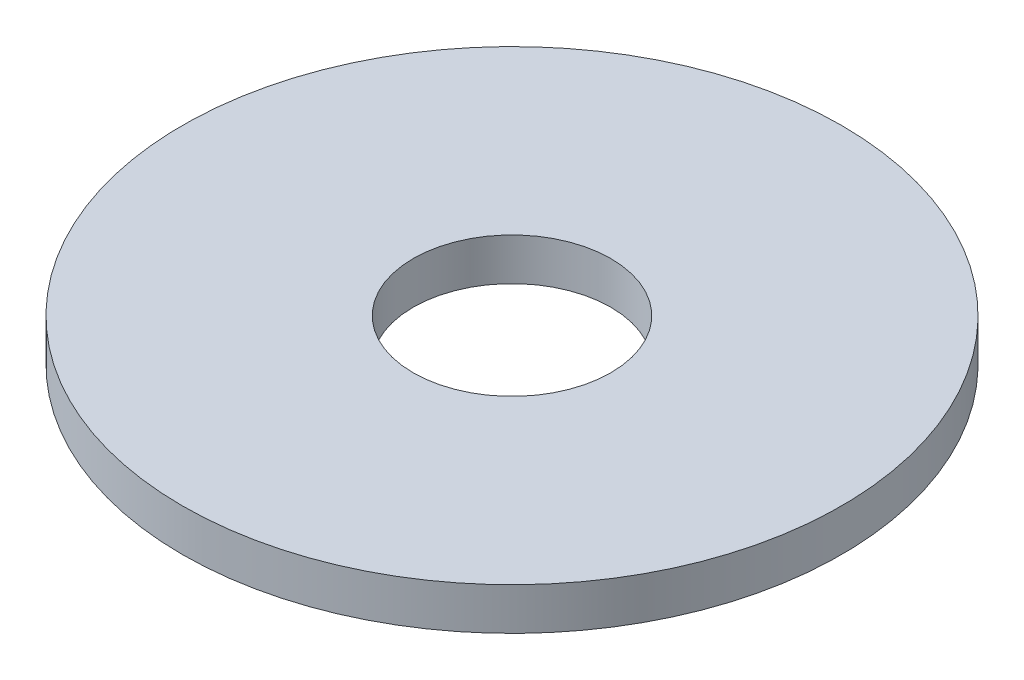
SolidWorks part; units mm, degrees
ref_plane "Front Plane" through (0, 0, 0) normal (0, 0, 1) x (1, 0, 0)
ref_plane "Top Plane" through (0, 0, 0) normal (0, 1, 0) x (1, 0, 0)
ref_plane "Right Plane" through (0, 0, 0) normal (1, 0, 0) x (0, 0, -1)
sketch "Sketch1" plane through (0, 0, 0) normal (0, 1, 0) x (1, 0, 0)
  circle A0 centre (0, 0) radius 15.875
  circle A1 centre (0, 0) radius 4.7625
  dimension "D1" = 31.75
  dimension "D2" = 9.525
extrude "Boss-Extrude1" add sketch "Sketch1" along normal blind 2.032
